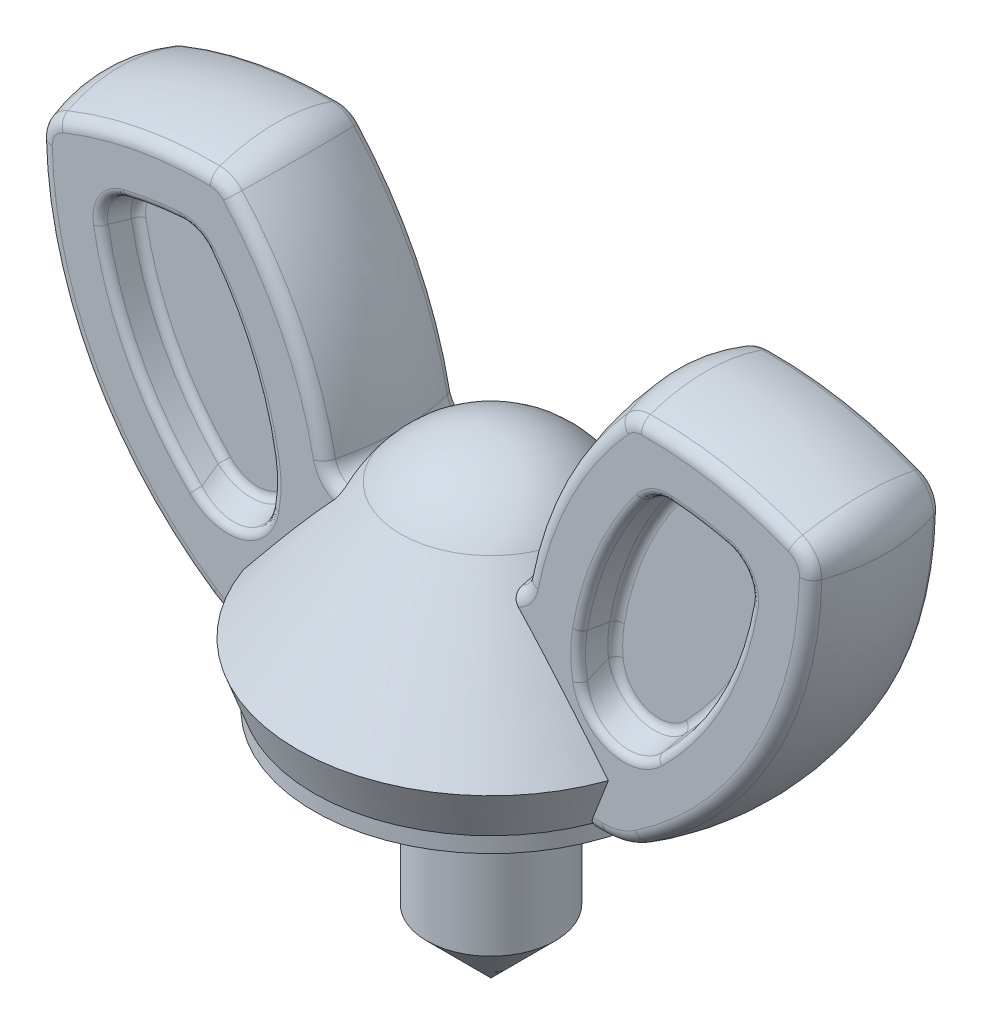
SolidWorks part; units mm, degrees
ref_plane "Front Plane" through (0, 0, 0) normal (0, 0, 1) x (1, 0, 0)
ref_plane "Top Plane" through (0, 0, 0) normal (0, 1, 0) x (1, 0, 0)
ref_plane "Right Plane" through (0, 0, 0) normal (1, 0, 0) x (0, 0, -1)
other "Configuration Table"
sketch "Sketch1" plane through (0, 0, 0) normal (0, 0, 1) x (1, 0, 0)
  line L0 (0, 10.7344) -> (0, 0) construction
  line L5 (4.826, 0) -> (-4.826, 0)
  line L6 (2.413, 5.08) -> (-2.413, 5.08)
  arc A11 (-2.413, 5.08) -> (-5.3975, 10.9034) centre (-13.1787, 3.2391) ccw
  arc A13 (-5.3975, 10.9034) -> (-10.795, 9.8298) centre (-6.0342, 0) ccw
  arc A24 (-10.795, 9.8298) -> (-6.0486, 0.3742) centre (0, 9.3295) ccw
  arc A26 (-4.826, 0) -> (-6.0486, 0.3742) centre (-4.826, 2.1844) cw
  arc A29 (4.826, 0) -> (6.0486, 0.3742) centre (4.826, 2.1844) ccw
  arc A34 (10.795, 9.8298) -> (6.0486, 0.3742) centre (0, 9.3295) cw
  arc A36 (5.3975, 10.9034) -> (10.795, 9.8298) centre (6.0342, 0) cw
  arc A37 (2.413, 5.08) -> (5.3975, 10.9034) centre (13.1787, 3.2391) cw
  point P19 (0, 0)
  point P27 (0, 5.08)
  point P29 (0, 5.08)
  point P44 (0, 5.08)
extrude "Extrude1" add sketch "Sketch1" along normal mid plane 3.556
fillet "Fillet4" radius 1.0922 4 edges at (10.795, 9.8298, 0) (5.3975, 10.9034, 0) (-5.3975, 10.9034, 0) (-10.795, 9.8298, 0)
sketch "Sketch2" plane through (0, 0, 1.778) normal (0, 0, 1) x (1, 0, 0)
  line L0 (0, 0) -> (0, 12.8329) construction
  line L1 (-4.826, 0) -> (4.826, 0) construction
  arc A10 (-4.1864, 4.7767) -> (-5.0416, 1.8652) centre (-7.5893, 4.1949) cw
  arc A11 (4.1864, 4.7767) -> (6.2055, 9.1212) centre (13.1787, 3.2391) cw
  arc A12 (6.2055, 9.1212) -> (8.9805, 8.634) centre (6.0342, 0) cw
  arc A13 (8.9805, 8.634) -> (5.0416, 1.8652) centre (0, 9.3295) cw
  arc A14 (4.1864, 4.7767) -> (5.0416, 1.8652) centre (7.5893, 4.1949) ccw
  arc A15 (-8.9805, 8.634) -> (-5.0416, 1.8652) centre (0, 9.3295) ccw
  arc A16 (-6.2055, 9.1212) -> (-8.9805, 8.634) centre (-6.0342, 0) ccw
  arc A17 (-4.1864, 4.7767) -> (-6.2055, 9.1212) centre (-13.1787, 3.2391) ccw
  arc A18 (-8.9805, 8.634) -> (-5.0416, 1.8652) centre (0, 9.3295) ccw
  arc A19 (-6.2055, 9.1212) -> (-8.9805, 8.634) centre (-6.0342, 0) ccw
  arc A20 (-4.1864, 4.7767) -> (-6.2055, 9.1212) centre (-13.1787, 3.2391) ccw
extrude "Cut-Extrude1" cut sketch "Sketch2" against normal blind 0.889 draft 10
fillet "Fillet1" radius 0.889 4 edges
fillet "Fillet6" radius 1.2446 2 edges
fillet "Fillet5" radius 0.3641 2 edges at (2.413, 5.08, 0) (-2.413, 5.08, 0)
fillet "Fillet3" radius 0.2223 28 edges at (7.4585, 9.011, 1.778) (7.4007, 8.8613, 0.889) (6.4621, 8.9114, 0.889) (8.6146, 8.3041, 0.889) (7.8855, 5.3103, 0.889) (4.2988, 4.3764, 0.889) (6.1282, 8.9579, 1.778) (8.7221, 8.5339, 1.778) (7.9776, 5.1471, 1.778) (4.1377, 4.1292, 1.778) (-4.2988, 4.3764, 0.889) (-7.8855, 5.3103, 0.889) (-8.5332, 8.4279, 0.889) (-7.4007, 8.8613, 0.889) (-6.1942, 8.7899, 0.889) (-4.1377, 4.1292, 1.778) (-7.9776, 5.1471, 1.778) (-8.7866, 8.4358, 1.778) (-7.4585, 9.011, 1.778) (-6.3795, 9.0717, 1.778) (4.9351, 6.7652, 0.889) (4.81, 6.8709, 1.778) (-4.9351, 6.7652, 0.889) (-4.81, 6.8709, 1.778) (4.9742, 2.938, 0.889) (5.0791, 2.5366, 1.778) (-5.2102, 2.8514, 0.889) (-5.0131, 2.5568, 1.778)
mirror "Mirror1" about plane through (0, 0, 0) normal (0, 0, 1) of "Fillet6", "Fillet3", "Fillet1", "Cut-Extrude1"
sketch "Sketch4" plane through (0, 0, 0) normal (1, 0, 0) x (0, 0, -1)
  line L1 (-1.778, 5.334) -> (1.778, 5.334)
  line L2 (-1.778, 4.4704) -> (-1.778, 5.334)
  line L4 (1.778, 0.3742) -> (1.778, 9.0918) construction
  line L6 (-1.778, 9.0918) -> (-1.778, 0.3742) construction
  line L7 (0, 5.715) -> (0, 0.381) construction
  line L9 (1.778, 4.4704) -> (1.778, 5.334)
  line L10 (-1.778, 5.08) -> (1.778, 5.08) construction
  arc A0 (-1.524, 4.826) -> (-1.778, 4.4704) centre (-1.4021, 4.4704) ccw
  arc A1 (1.524, 4.826) -> (-1.524, 4.826) centre (0, 0.381) ccw
  arc A2 (1.524, 4.826) -> (1.778, 4.4704) centre (1.4021, 4.4704) cw
  point P8 (0, 5.08)
sketch3d "3DSketch1"
  line L2 (-2.1102, 5.08, 1.778) -> (2.1102, 5.08, 1.778)
  line L3 (4.826, 0, 1.778) -> (-4.826, 0, 1.778)
  line L4 (-2.1102, 5.08, 1.778) -> (2.1102, 5.08, 1.778)
  line L5 (4.826, 0, 1.778) -> (-4.826, 0, 1.778)
  arc A15 (10.804, 9.0918, 1.778) -> (6.0486, 0.3742, 1.778) centre (0, 9.3295, 1.778) ccw
  arc A16 (10.1207, 10.1287, 1.778) -> (10.804, 9.0918, 1.778) centre (9.712, 9.1158, 1.778) ccw
  arc A17 (5.8682, 10.9207, 1.778) -> (10.1207, 10.1287, 1.778) centre (6.0342, 0, 1.778) ccw
  arc A18 (5.0743, 10.5608, 1.778) -> (5.8682, 10.9207, 1.778) centre (5.8848, 9.8287, 1.778) ccw
  arc A19 (2.4672, 5.3729, 1.778) -> (5.0743, 10.5608, 1.778) centre (13.1787, 3.2391, 1.778) ccw
  arc A20 (2.1102, 5.08, 1.778) -> (2.4672, 5.3729, 1.778) centre (2.1102, 5.4441, 1.778) ccw
  arc A21 (2.1102, 5.08, 1.778) -> (2.4672, 5.3729, 1.778) centre (2.1102, 5.4441, 1.778) ccw
  arc A22 (-5.0743, 10.5608, 1.778) -> (-2.4672, 5.3729, 1.778) centre (-13.1787, 3.2391, 1.778) ccw
  arc A23 (-5.8682, 10.9207, 1.778) -> (-5.0743, 10.5608, 1.778) centre (-5.8848, 9.8287, 1.778) ccw
  arc A24 (-10.1207, 10.1287, 1.778) -> (-5.8682, 10.9207, 1.778) centre (-6.0342, 0, 1.778) ccw
  arc A25 (-10.804, 9.0918, 1.778) -> (-10.1207, 10.1287, 1.778) centre (-9.712, 9.1158, 1.778) ccw
  arc A26 (-6.0486, 0.3742, 1.778) -> (-10.804, 9.0918, 1.778) centre (0, 9.3295, 1.778) ccw
  arc A27 (-4.826, 0, 1.778) -> (-6.0486, 0.3742, 1.778) centre (-4.826, 2.1844, 1.778) ccw
  arc A28 (6.0486, 0.3742, 1.778) -> (4.826, 0, 1.778) centre (4.826, 2.1844, 1.778) ccw
  arc A29 (10.804, 9.0918, 1.778) -> (6.0486, 0.3742, 1.778) centre (0, 9.3295, 1.778) ccw
  arc A30 (10.1207, 10.1287, 1.778) -> (10.804, 9.0918, 1.778) centre (9.712, 9.1158, 1.778) ccw
  arc A31 (5.8682, 10.9207, 1.778) -> (10.1207, 10.1287, 1.778) centre (6.0342, 0, 1.778) ccw
  arc A32 (5.0743, 10.5608, 1.778) -> (5.8682, 10.9207, 1.778) centre (5.8848, 9.8287, 1.778) ccw
  arc A33 (2.4672, 5.3729, 1.778) -> (5.0743, 10.5608, 1.778) centre (13.1787, 3.2391, 1.778) ccw
  arc A34 (-2.4672, 5.3729, 1.778) -> (-2.1102, 5.08, 1.778) centre (-2.1102, 5.4441, 1.778) ccw
  arc A35 (-2.4672, 5.3729, 1.778) -> (-2.1102, 5.08, 1.778) centre (-2.1102, 5.4441, 1.778) ccw
  arc A36 (-5.0743, 10.5608, 1.778) -> (-2.4672, 5.3729, 1.778) centre (-13.1787, 3.2391, 1.778) ccw
  arc A37 (-5.8682, 10.9207, 1.778) -> (-5.0743, 10.5608, 1.778) centre (-5.8848, 9.8287, 1.778) ccw
  arc A38 (-10.1207, 10.1287, 1.778) -> (-5.8682, 10.9207, 1.778) centre (-6.0342, 0, 1.778) ccw
  arc A39 (-10.804, 9.0918, 1.778) -> (-10.1207, 10.1287, 1.778) centre (-9.712, 9.1158, 1.778) ccw
  arc A40 (-6.0486, 0.3742, 1.778) -> (-10.804, 9.0918, 1.778) centre (0, 9.3295, 1.778) ccw
  arc A41 (-4.826, 0, 1.778) -> (-6.0486, 0.3742, 1.778) centre (-4.826, 2.1844, 1.778) ccw
  arc A42 (6.0486, 0.3742, 1.778) -> (4.826, 0, 1.778) centre (4.826, 2.1844, 1.778) ccw
  point P3 (2.1102, 5.4441, 2.1421)
  point P5 (2.1102, 5.4441, 2.1421)
  point P11 (-2.1102, 5.4441, 2.1421)
  point P13 (-2.1102, 5.4441, 2.1421)
  point P43 (0, 9.3295, -9.0286)
  point P46 (9.712, 9.1158, 0.6858)
  point P48 (6.0342, 0, -9.144)
  point P50 (5.8848, 9.8287, 0.6858)
  point P52 (13.1787, 3.2391, -9.144)
  point P58 (-13.1787, 3.2391, -9.144)
  point P60 (-5.8848, 9.8287, 0.6858)
  point P62 (-6.0342, 0, -9.144)
  point P64 (-9.712, 9.1158, 0.6858)
  point P66 (0, 9.3295, -9.0286)
  point P68 (-4.826, 2.1844, -0.4064)
  point P70 (4.826, 2.1844, -0.4064)
  point P71 (0, 9.3295, -9.0286)
  point P72 (9.712, 9.1158, 0.6858)
  point P73 (6.0342, 0, -9.144)
  point P74 (5.8848, 9.8287, 0.6858)
  point P75 (13.1787, 3.2391, -9.144)
  point P78 (-13.1787, 3.2391, -9.144)
  point P79 (-5.8848, 9.8287, 0.6858)
  point P80 (-6.0342, 0, -9.144)
  point P81 (-9.712, 9.1158, 0.6858)
  point P82 (0, 9.3295, -9.0286)
  point P83 (-4.826, 2.1844, -0.4064)
  point P84 (4.826, 2.1844, -0.4064)
  dimension "D1" = 0
sweep "Cut-Sweep2" cut profiles "Sketch4" path "3DSketch1"
sketch "Sketch3" plane through (0, 0, 0) normal (0, 0, 1) x (1, 0, 0)
  line L0 (0, 6.5903) -> (0, -11.3525) construction
  line L1 (1.7526, 0) -> (4.826, 0)
  line L2 (5.2882, 1.6933) -> (2.4672, 5.3729)
  line L4 (1.7526, 0) -> (1.7526, -6.35)
  line L5 (1.7526, -6.35) -> (0, -6.35)
  line L6 (4.826, 0) -> (4.826, 0.4233)
  line L7 (0, 6.5903) -> (0, -6.35)
  line L8 (0, 6.5903) -> (-2.4754, 6.5903) construction
  line L9 (4.826, 0.4233) -> (5.2882, 1.6933)
  arc A1 (2.4672, 5.3729) -> (0, 6.5903) centre (0, 3.4814) ccw
revolve "Revolve1" add sketch "Sketch3" angle 360 about L0
sketch "Sketch6" plane through (0, 0, 0) normal (0, 0, 1) x (1, 0, 0)
  line L0 (0, 4.5862) -> (0, -8.2597) construction
  line L1 (0, -6.35) -> (2.0066, -4.3434)
  line L2 (-1.7526, -6.35) -> (1.7526, -6.35) construction
  line L3 (2.0066, -4.3434) -> (2.0066, -6.604)
  line L4 (2.0066, -6.604) -> (0, -6.604)
  line L5 (0, -6.604) -> (0, -6.35)
  line L8 (1.7526, -6.35) -> (1.7526, 0) construction
  dimension "D1" = 135
  dimension "D2" = 0.254
  dimension "D3" = 0.254
revolve "Cut-Revolve11" cut sketch "Sketch6" angle 360 about L0
sketch "Sketch5" plane through (0, 0, 0) normal (0, 0, 1) x (1, 0, 0)
  line L0 (1.7526, -0.0254) -> (1.2802, -0.2982)
  line L1 (1.2802, -0.2982) -> (1.7526, -0.5709)
  line L2 (1.7526, -0.5709) -> (1.7526, -0.0254)
  line L3 (0, 0) -> (0, -7.7715) construction
  line L6 (1.2802, -0.2982) -> (1.2802, -1.0906) construction
revolve "Cut-Revolve10" [suppressed] cut sketch "Sketch5" angle 360 about L3
pattern_linear "LPattern10" [suppressed] count 8 spacing 0.7925 along (0, -1, 0)
equation "\"D5@Sketch1\" = \"E@Sketch1\" / 2"
equation "\"D1@Sketch1\" = \"A@Sketch1\" / 4"
equation "\"D3@Sketch1\" = \"B@Sketch1\" * 9 /  10"
equation "\"D4@Sketch1\" = \"B@Sketch1\""
equation "\"D2@Sketch1\" = \"D4@Sketch1\" / 5"
equation "\"D1@Cut-Extrude1\" = \"C@Extrude1\" / 4"
equation "\"D1@Fillet1\" = \"D1@Cut-Extrude1\""
equation "\"D1@Fillet3\" = \"D1@Cut-Extrude1\" / 4"
equation "\"D2@Sketch3\" = \"G@Sketch1\" / 4"
equation "\"D3@Sketch3\" = \"E@Sketch1\""
equation "\"D1@Sketch4\" = \"C@Extrude1\" / 14"
equation "\"D1@Sketch5\" = \"d1@Sketch3\""
equation "\"D2@Sketch5\" = \"THD_MINOR@Cosmetic Thread1\""
equation "\"D3@LPattern10\" = \"pitch@Sketch5\""
equation "\"D1@LPattern10\" = \"L@Sketch3\" / \"D3@LPattern10\""
equation "\"D1@Cosmetic Thread1\" = \"L@Sketch3\""
equation "\"D2@Sketch4\" = \"D1@Sketch4\""
equation "\"D4@Sketch3\" = \"D2@Sketch3\" / 3"
equation "\"D1@Fillet4\" = \"D2@Sketch1\" /2"
equation "\"D1@Sketch2\" = \"D1@Sketch1\" / 3"
equation "\"D1@Fillet5\" = \"D1@Fillet4\" / 3"
equation "\"D1@Fillet6\" = \"D1@Fillet1\" * 1.4"
